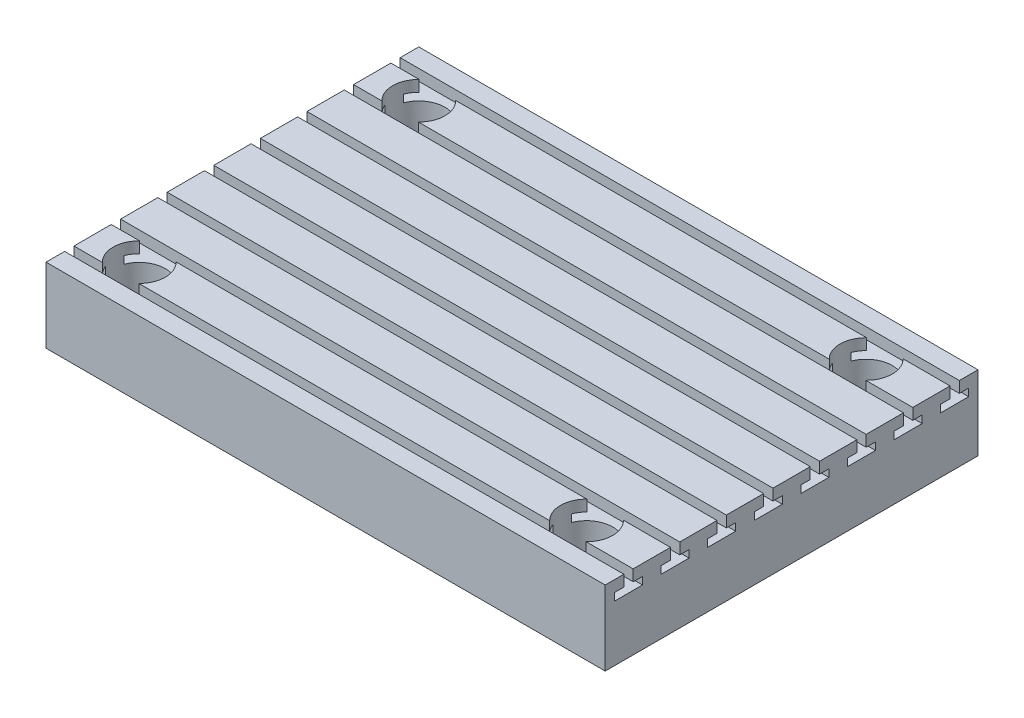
SolidWorks part; units mm, degrees
ref_plane "Front" through (0, 0, 0) normal (0, 0, 1) x (1, 0, 0)
ref_plane "Top" through (0, 0, 0) normal (0, 1, 0) x (1, 0, 0)
ref_plane "Right" through (0, 0, 0) normal (1, 0, 0) x (0, 0, -1)
sketch "Sketch1" plane through (0, 0, 0) normal (0, 1, 0) x (1, 0, 0)
  line L0 (75, -50) -> (-75, 50) construction
  line L1 (-75, 50) -> (75, 50)
  line L2 (-75, 50) -> (-75, -50)
  line L3 (-75, -50) -> (75, -50)
  line L4 (75, 50) -> (75, -50)
  dimension "D1" = 150
  dimension "D2" = 100
extrude "Extrude1" add sketch "Sketch1" along normal blind 20
hole_wizard "9/16 (0.5625) Diameter Hole1" positions "Sketch4" profile "Sketch3" hole size "9/16" standard "Ansi Inch"
sketch "Sketch4" plane through (0, 20, 0) normal (0, 1, 0) x (-1, 0, 0)
  line L0 (75, 50) -> (-75, 50) construction
  line L1 (75, -50) -> (75, 50) construction
  point P0 (62.5, 37.5)
  dimension "D1" = 12.5
  dimension "D2" = 12.5
sketch "Sketch3" plane through (-62.5, 20, 37.5) normal (1, 0, 0) x (0, 0, 1)
  line L0 (0, 0) -> (0, 20)
  line L1 (0, 20) -> (7, 20)
  line L2 (7, 20) -> (7, 0)
  line L5 (7, 0) -> (0, 0)
  line L11 (0, -6.35) -> (0, 107.95) construction
  dimension "Thru Hole Dia." = 14
  dimension "Thru Hole Depth" = 20
pattern_linear "LPattern1" count 2 spacing 120 along (1, 0, 0) count 2 spacing 75 along (0, 0, -1) of "9/16 (0.5625) Diameter Hole1"
sketch "Sketch5" plane through (75, 0, 0) normal (1, 0, 0) x (0, 0, -1)
  line L0 (-45, 20) -> (-45, 17)
  line L1 (-50, 20) -> (50, 20) construction
  line L2 (-45, 17) -> (-47.5, 17)
  line L3 (-47.5, 17) -> (-47.5, 15)
  line L4 (-47.5, 15) -> (-40, 15)
  line L5 (-40, 15) -> (-40, 17)
  line L6 (-40, 17) -> (-42.5, 17)
  line L7 (-42.5, 17) -> (-42.5, 20)
  line L8 (-42.5, 20) -> (-45, 20)
  line L9 (-43.75, 20) -> (-43.75, 15) construction
  line L10 (-50, 20) -> (-50, 0) construction
  dimension "D1" = 2.5
  dimension "D2" = 7.5
  dimension "D3" = 2
  dimension "D4" = 3
  dimension "D5" = 5
extrude "Cut-Extrude2" cut sketch "Sketch5" against normal through all
pattern_linear "LPattern2" count 8 spacing 12.5 along (0, 0, -1) of "Cut-Extrude2"
sketch "Sketch6" plane through (0, 20, 0) normal (0, 1, 0) x (-1, 0, 0)
  circle A0 centre (0, 0) radius 35
  dimension "D1" = 70
extrude "Cut-Extrude3" [suppressed] cut sketch "Sketch6" against normal blind 2
